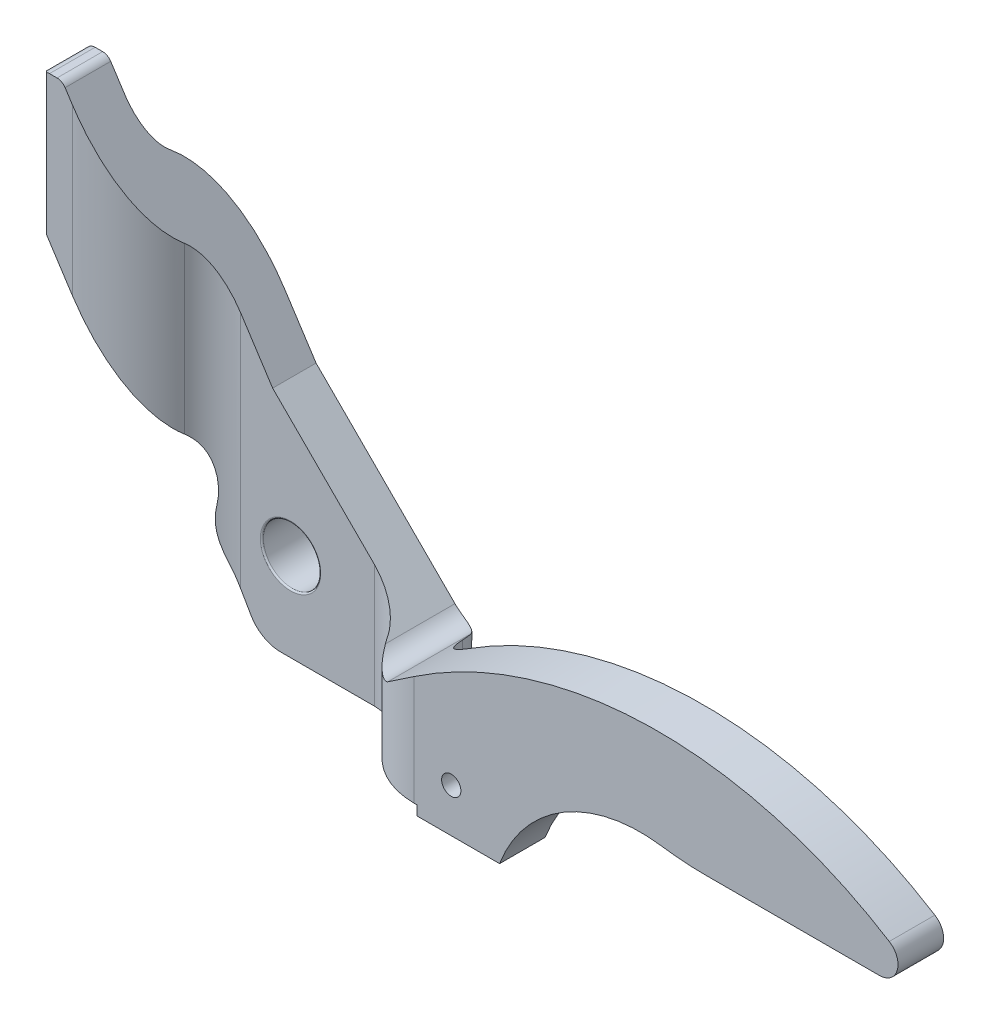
SolidWorks part; units mm, degrees
ref_plane "Front Plane" through (0, 0, 0) normal (0, 0, 1) x (1, 0, 0)
ref_plane "Top Plane" through (0, 0, 0) normal (0, 1, 0) x (1, 0, 0)
ref_plane "Right Plane" through (0, 0, 0) normal (1, 0, 0) x (0, 0, -1)
sketch "Sketch1" plane through (0, 0, 0) normal (0, 0, 1) x (1, 0, 0)
  line L0 (0, 24.4983) -> (0, 0) construction
  line L1 (0, 0) -> (63.2874, 0) construction
  line L2 (15.621, -8.001) -> (22.3716, -8.001)
  line L3 (15.621, -7.2136) -> (-0.8212, -7.2136)
  line L4 (15.621, -7.2136) -> (15.621, -8.001)
  line L5 (-4.9493, -2.8575) -> (-3.2409, -5.8166)
  line L6 (39.2294, -0.381) -> (53.467, -0.381)
  line L7 (0, 0) -> (-15.24, 23.4675) construction
  line L8 (-33.3081, 29.591) -> (-22.2149, 29.591) construction
  line L10 (-6.5664, 5.4944) -> (-15.24, 18.8505)
  line L12 (0, 29.591) -> (63.2874, 29.591) construction
  line L15 (0, 7.874) -> (63.2874, 7.874) construction
  line L16 (-15.24, 29.591) -> (-15.24, 18.8505)
  line L17 (-15.24, 29.591) -> (63.2874, 29.591) construction
  line L18 (-15.24, 29.591) -> (-13.8595, 29.591)
  line L19 (0, 0) -> (-20.6015, 20.6015) construction
  line L21 (9.9058, -0.2071) -> (-1.4654, 11.1641)
  line L22 (4.8493, 4.8493) -> (-15.7522, 25.4509) construction
  line L23 (-1.4654, 11.1641) -> (-13.1991, 29.2324)
  arc A0 (-4.9493, -2.8575) -> (-5.633, 0.9644) centre (0, 0) cw
  arc A1 (-0.8212, -7.2136) -> (-3.2409, -5.8166) centre (-0.8212, -4.4196) cw
  arc A2 (22.3716, -8.001) -> (35.6644, -0.1257) centre (33.909, -12.319) cw
  arc A3 (35.6644, -0.1257) -> (39.2294, -0.381) centre (39.2294, 24.638) ccw
  arc A4 (53.467, -0.381) -> (54.2757, 2.4347) centre (53.467, 1.143) ccw
  circle A5 centre (0, 0) radius 2.3495
  arc A6 (-6.5664, 5.4944) -> (-5.633, 0.9644) centre (-11.892, 2.0359) cw
  arc A7 (-13.1991, 29.2324) -> (-13.8595, 29.591) centre (-13.8595, 28.8036) ccw
  arc A9 (12.5707, -0.3318) -> (54.2757, 2.4347) centre (35.338, -27.8131) cw
  arc A10 (9.9058, -0.2071) -> (12.5707, -0.3318) centre (11.3067, 1.1938) ccw
  circle A11 centre (18.415, -4.4196) radius 0.7874
  dimension "D1" = 5.715
  dimension "D5" = 2.794
  dimension "D7" = 12.319
  dimension "D11" = 25.019
  dimension "D12" = 1.524
  dimension "D13" = 4.699
  dimension "D18" = 6.35
  dimension "D19" = 0.7874
  dimension "D21" = 4.8514
  dimension "D16" = 1.9812
  dimension "D26" = 1.5748
  dimension "D2" = 8.001
  dimension "D3" = 0.7874
  dimension "D4" = 15.621
  dimension "D6" = 30
  dimension "D8" = 33.909
  dimension "D9" = 0.381
  dimension "D10" = 53.467
  dimension "D14" = 57
  dimension "D22" = 15.24
  dimension "D23" = 45
  dimension "D17" = 1.1938
  dimension "D25" = 7.366
  dimension "D27" = 18.415
  dimension "D28" = 3.5814
  dimension "D15" = 29.591
  dimension "D20" = 7.874
  dimension "D24" = 6.858
extrude "Boss-Extrude1" add sketch "Sketch1" along normal blind 8.8138
fillet "Fillet1" radius 0.762 1 edges at (-15.24, 29.591, 4.4069)
fillet "Fillet2" radius 3.175 1 edges at (-15.24, 18.8505, 4.4069)
sketch "Sketch2" plane through (0, 0, 0) normal (0, 1, 0) x (1, 0, 0)
  line L2 (-6.35, -3.556) -> (6.858, -3.556)
  line L3 (9.9058, 0) -> (-1.4654, 0) construction
  line L4 (-6.35, -3.556) -> (-6.35, -12.3625)
  line L5 (9.9058, -8.8138) -> (-1.4654, -8.8138) construction
  line L6 (54.6663, -8.8138) -> (15.3737, -8.8138)
  line L7 (53.467, -8.8138) -> (54.991, -8.8138) construction
  line L8 (54.6663, -8.8138) -> (54.6663, -12.3625)
  line L9 (54.6663, -12.3625) -> (-6.35, -12.3625)
  arc A0 (6.858, -3.556) -> (9.6966, -5.3086) centre (6.858, -6.731) cw
  arc A1 (15.3737, -8.8138) -> (9.6966, -5.3086) centre (15.3737, -2.4638) cw
  point P2 (-6.35, -3.556)
  point P6 (-6.5539, -3.556)
  point P8 (-6.1877, -3.556)
  dimension "D3" = 3.175
  dimension "D5" = 6.35
  dimension "D2" = 3.556
  dimension "D4" = 6.35
extrude "Cut-Extrude2" cut sketch "Sketch2" against normal through all both and the other way through all
sketch "Sketch3" plane through (0, 0, 0) normal (0, 1, 0) x (1, 0, 0)
  line L0 (54.991, -5.08) -> (16.1866, -5.08)
  line L1 (54.991, -8.8138) -> (54.991, 0) construction
  line L3 (12.5707, 0) -> (9.9058, 0) construction
  line L4 (9.9649, 0) -> (9.9649, 0.8498)
  line L5 (9.9649, 0.8498) -> (54.991, 0.8498)
  line L6 (54.991, 0.8498) -> (54.991, -5.08)
  line L7 (54.6663, -8.8138) -> (15.3737, -8.8138) construction
  arc A7 (16.1866, -5.08) -> (13.0758, -2.54) centre (16.1866, -1.905) cw
  arc A8 (13.0758, -2.54) -> (9.9649, 0) centre (9.9649, -3.175) ccw
  dimension "D2" = 3.175
  dimension "D3" = 3.175
  dimension "D1" = 3.7338
extrude "Cut-Extrude3" cut sketch "Sketch3" against normal through all both and the other way through all
sketch "Sketch4" plane through (0, 0, 0) normal (0, 0, -1) x (-1, 0, 0)
  line L0 (6.35, 5.1358) -> (6.35, 18.6857) construction
  line L1 (17.7338, 32.5421) -> (9.525, 32.5421)
  line L2 (17.7338, 32.5421) -> (17.7338, 0)
  line L3 (17.7338, 0) -> (9.525, 0)
  line L4 (9.525, 32.5421) -> (9.525, 0)
  dimension "D1" = 3.175
extrude "Cut-Extrude5" cut sketch "Sketch4" against normal offset from surface (5.08 mm away) 3.7338
fillet "Fillet3" radius 2.54 1 edges at (-9.525, 16.8125, 5.08)
fillet "Fillet4" radius 6.35 8 edges at (-8.0457, 7.7723, 0) (-9.525, 23.5748, 1.27) (-9.525, 16.8125, 0) (-5.6257, -1.0064, 0) (-5.6726, 3.3174, 0) (-9.525, 10.0502, 1.27) (-9.525, 16.8125, 2.54) (-10.2689, 24.7203, 4.3361)
fillet "Fillet5" radius 6.35 1 edges at (-6.35, 11.9107, 8.8138)
fillet "Fillet6" radius 3.175 1 edges at (-6.35, 11.9107, 3.556)
sketch "Sketch5" plane through (0, 0, 0) normal (0, 0, -1) x (-1, 0, 0)
  circle A0 centre (0, 0) radius 2.3495 construction
  circle A1 centre (0, 0) radius 2.3495
  circle A2 centre (0, 0) radius 5.715
  dimension "D1" = 11.43
extrude "Boss-Extrude4" add sketch "Sketch5" along normal blind 0.1016
chamfer "Chamfer1" distance 0.508 angle 45 1 edges at (-15.24, 24.31, 8.8138)
fillet "Fillet7" radius 0.127 2 edges at (-2.3495, 0, -0.1016) (-2.3495, 0, 3.556)
